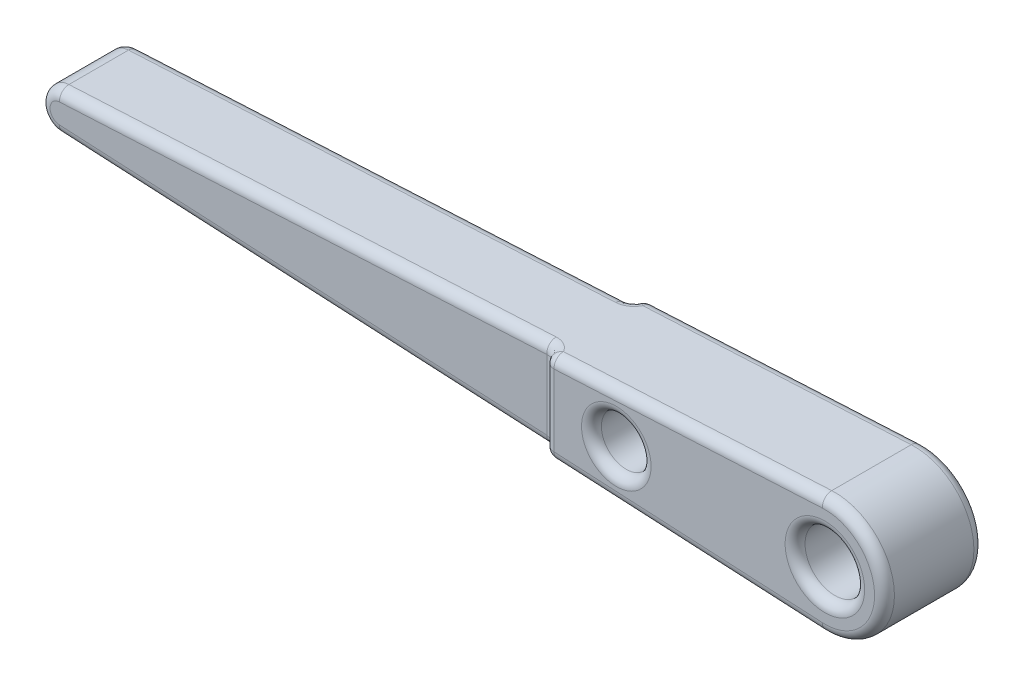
SolidWorks part; units mm, degrees
ref_plane "Спереди" through (0, 0, 0) normal (0, 0, 1) x (1, 0, 0)
ref_plane "Сверху" through (0, 0, 0) normal (0, 1, 0) x (1, 0, 0)
ref_plane "Справа" through (0, 0, 0) normal (1, 0, 0) x (0, 0, -1)
sketch "Эскиз1" plane through (0, 0, 0) normal (0, 0, 1) x (1, 0, 0)
  line L0 (0, 0) -> (-39, 0) construction
  line L1 (-0.1538, 2.9961) -> (-39.0513, 0.9987)
  line L2 (-0.1538, -2.9961) -> (-39.0513, -0.9987)
  arc A0 (-0.1538, -2.9961) -> (-0.1538, 2.9961) centre (0, 0) ccw
  circle A1 centre (0, 0) radius 1.5
  circle A2 centre (-10.5, 0) radius 1.25
  arc A3 (-39.0513, 0.9987) -> (-39.0513, -0.9987) centre (-39, 0) ccw
  dimension "D1" = 6
  dimension "D2" = 3
  dimension "D3" = 2.5
  dimension "D5" = 2
  dimension "D4" = 10.5
  dimension "D6" = 39
extrude "Бобышка-Вытянуть1" add sketch "Эскиз1" along normal mid plane 4
sketch "Эскиз2" plane through (0, 0, 0) normal (0, 0, 1) x (1, 0, 0)
  line L0 (-14, 2.2851) -> (-14, -2.2851)
  line L2 (-0.1538, 2.9961) -> (-39.0513, 0.9987)
  line L3 (-39.0513, -0.9987) -> (-0.1538, -2.9961)
  line L4 (-0.1538, 2.9961) -> (-14, 2.2851)
  line L5 (-14, -2.2851) -> (-0.1538, -2.9961)
  circle A2 centre (-10.5, 0) radius 1.25
  arc A3 (-0.1538, -2.9961) -> (-0.1538, 2.9961) centre (0, 0) ccw
  arc A4 (-39.0513, 0.9987) -> (-39.0513, -0.9987) centre (-39, 0) ccw
  arc A5 (-0.1538, -2.9961) -> (-0.1538, 2.9961) centre (0, 0) ccw
  circle A6 centre (-10.5, 0) radius 1.25
  circle A7 centre (0, 0) radius 1.5
  circle A8 centre (0, 0) radius 1.5
  dimension "D2" = 14
  dimension "D1" = 0
  dimension "D3" = 0
  dimension "D4" = 0
extrude "Бобышка-Вытянуть2" add sketch "Эскиз2" along normal mid plane 5
fillet "Скругление1" radius 0.5 12 edges at (-26.5256, -1.6419, 2) (-40, 0, 2) (-26.5256, -1.6419, -2) (-40, 0, -2) (1.5, 0, 2.5) (1.5, 0, -2.5) (-9.25, 0, 2.5) (-9.25, 0, -2.5) (-26.5256, 1.6419, 2) (-26.5256, 1.6419, -2) (-14, 0, -2) (-14, 0, 2)
fillet "Скругление3" radius 0.5 12 edges at (3, 0, -2.5) (-6.8397, -2.6527, -2.5) (-13.8625, -2.1544, -2.5) (-14, 0, -2.5) (-13.8625, 2.1544, -2.5) (3, 0, 2.5) (-6.8397, -2.6527, 2.5) (-13.8625, -2.1544, 2.5) (-14, 0, 2.5) (-13.8625, 2.1544, 2.5) (-6.8397, 2.6527, -2.5) (-6.8397, 2.6527, 2.5)
